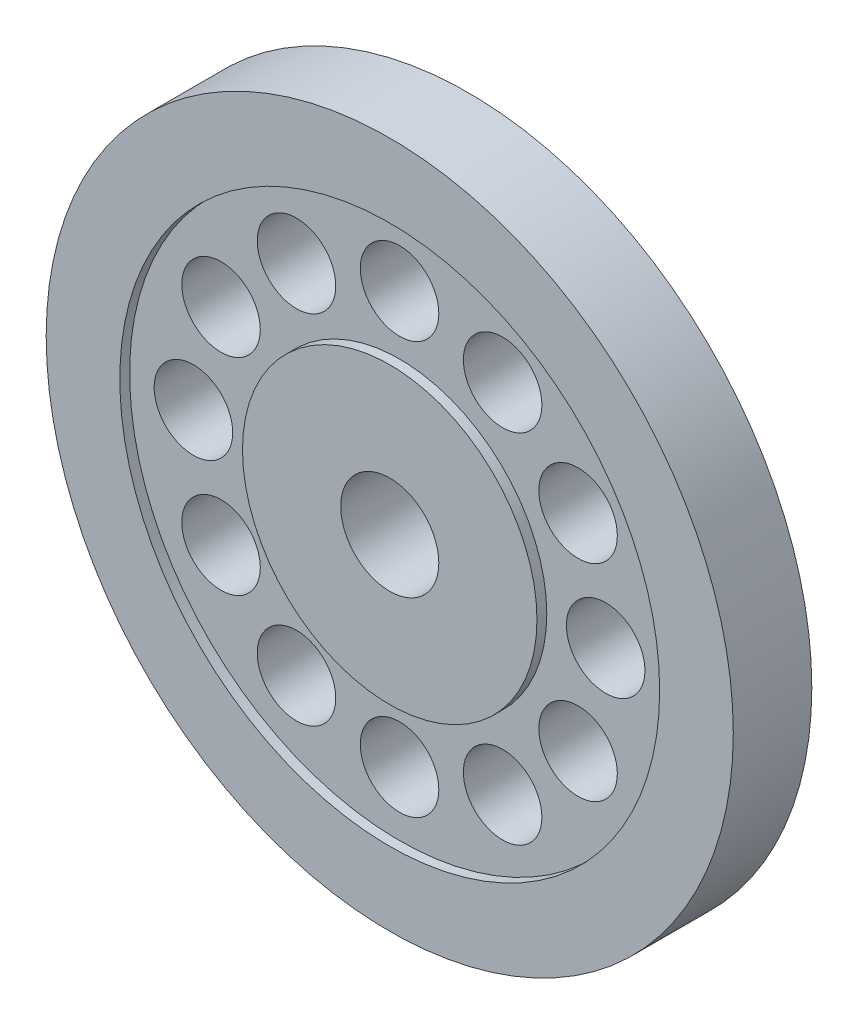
SolidWorks part; units mm, degrees
ref_plane "Front" through (0, 0, 0) normal (0, 0, 1) x (1, 0, 0)
ref_plane "Top" through (0, 0, 0) normal (0, 1, 0) x (1, 0, 0)
ref_plane "Right" through (0, 0, 0) normal (1, 0, 0) x (0, 0, -1)
sketch "Esquisse1" plane through (0, 0, 0) normal (0, 0, 1) x (1, 0, 0)
  circle A0 centre (0, 0) radius 35
  dimension "D1" = 70
extrude "Boss.-Extru.1" add sketch "Esquisse1" along normal blind 8
sketch "Esquisse2" plane through (0, 0, 8) normal (0, 0, 1) x (1, 0, 0)
  circle A0 centre (0, 0) radius 27.5
  circle A1 centre (0, 0) radius 15
  dimension "D1" = 30
  dimension "D2" = 55
extrude "Enlèv. mat.-Extru.1" cut sketch "Esquisse2" against normal blind 1
hole_wizard "Diamètre du perçage Ø0.15 (0.15)1" positions "Esquisse4" profile "Esquisse3" hole size "Ø0.15" standard "Ansi Metric"
sketch "Esquisse4" plane through (0, 0, 8) normal (0, 0, 1) x (1, 0, 0)
  point P0 (0, 0)
sketch "Esquisse3" plane through (0, 0, 8) normal (1, 0, 0) x (0, -1, 0)
  line L0 (0, 0) -> (0, 8)
  line L1 (0, 8) -> (5, 8)
  line L2 (5, 8) -> (5, 0)
  line L5 (5, 0) -> (0, 0)
  line L11 (0, -6.35) -> (0, 107.95) construction
  dimension "Diamètre du perçage jusqu'au prochain" = 10
  dimension "Profondeur du perçage jusqu'au prochain" = 8
hole_wizard "Diamètre du perçage Ø0.15 (0.15)2" positions "Esquisse6" profile "Esquisse5" hole size "Ø0.15" standard "Ansi Metric"
sketch "Esquisse6" plane through (0, 0, 7) normal (0, 0, 1) x (1, 0, 0)
  point P0 (0, 21)
  dimension "D1" = 21
sketch "Esquisse5" plane through (0, 21, 7) normal (1, 0, 0) x (0, -1, 0)
  line L0 (0, 0) -> (0, 7.001)
  line L1 (0, 7.001) -> (4, 7.001)
  line L2 (4, 7.001) -> (4, 0)
  line L5 (4, 0) -> (0, 0)
  line L11 (0, -6.35) -> (0, 107.95) construction
  dimension "Diamètre du perçage jusqu'au prochain" = 8
  dimension "Profondeur du perçage jusqu'au prochain" = 7.001
pattern_circular "Répétition circulaire1" count 12 over 360 about axis through (0, 0, 0) along (0, 0, 1) of "Diamètre du perçage Ø0.15 (0.15)2"
